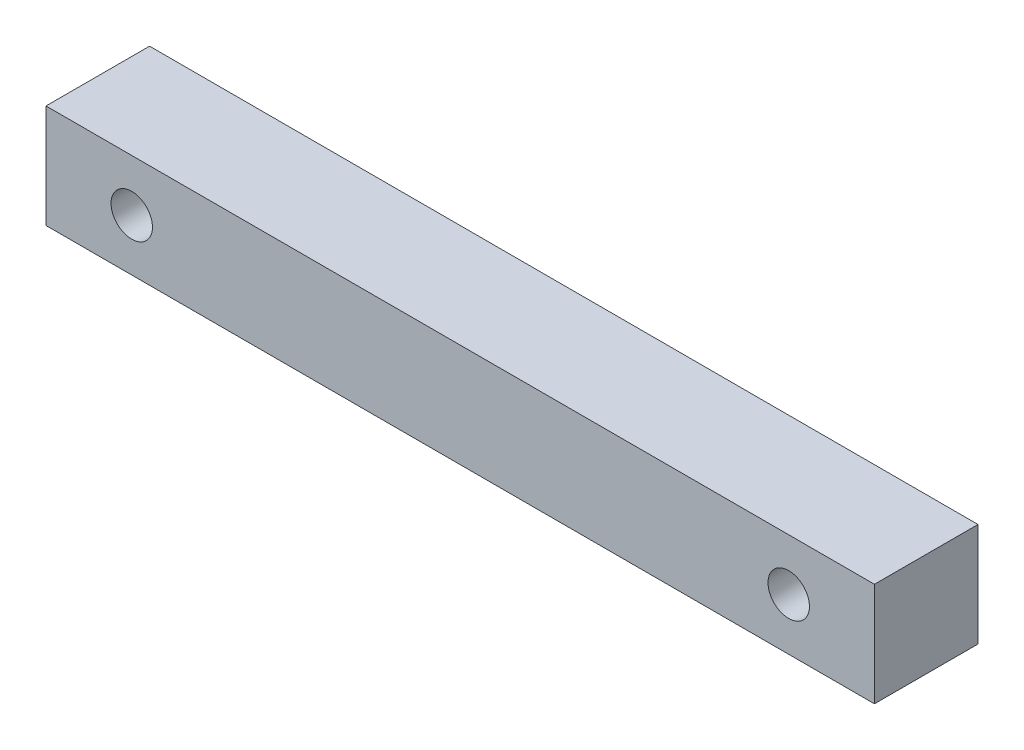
SolidWorks part; units mm, degrees
ref_plane "Front Plane" through (0, 0, 0) normal (0, 0, 1) x (1, 0, 0)
ref_plane "Top Plane" through (0, 0, 0) normal (0, 1, 0) x (1, 0, 0)
ref_plane "Right Plane" through (0, 0, 0) normal (1, 0, 0) x (0, 0, -1)
sketch "Sketch1" plane through (0, 0, 0) normal (0, 0, 1) x (1, 0, 0)
  line L1 (-20, 2.5) -> (20, 2.5)
  line L2 (-20, 2.5) -> (-20, -2.5)
  line L3 (-20, -2.5) -> (20, -2.5)
  line L4 (20, 2.5) -> (20, -2.5)
extrude "Boss-Extrude1" add sketch "Sketch1" along normal blind 5
sketch "Sketch2" plane through (0, 0, 5) normal (0, 0, 1) x (1, 0, 0)
  line L0 (-20, 2.5) -> (-20, -2.5) construction
  line L1 (20, -2.5) -> (20, 2.5) construction
  circle A0 centre (-15.8603, 0) radius 1
  circle A1 centre (15.8603, 0) radius 1
  dimension "D1" = 4.1397
  dimension "D2" = 4.1397
extrude "Cut-Extrude1" cut sketch "Sketch2" against normal blind 5
